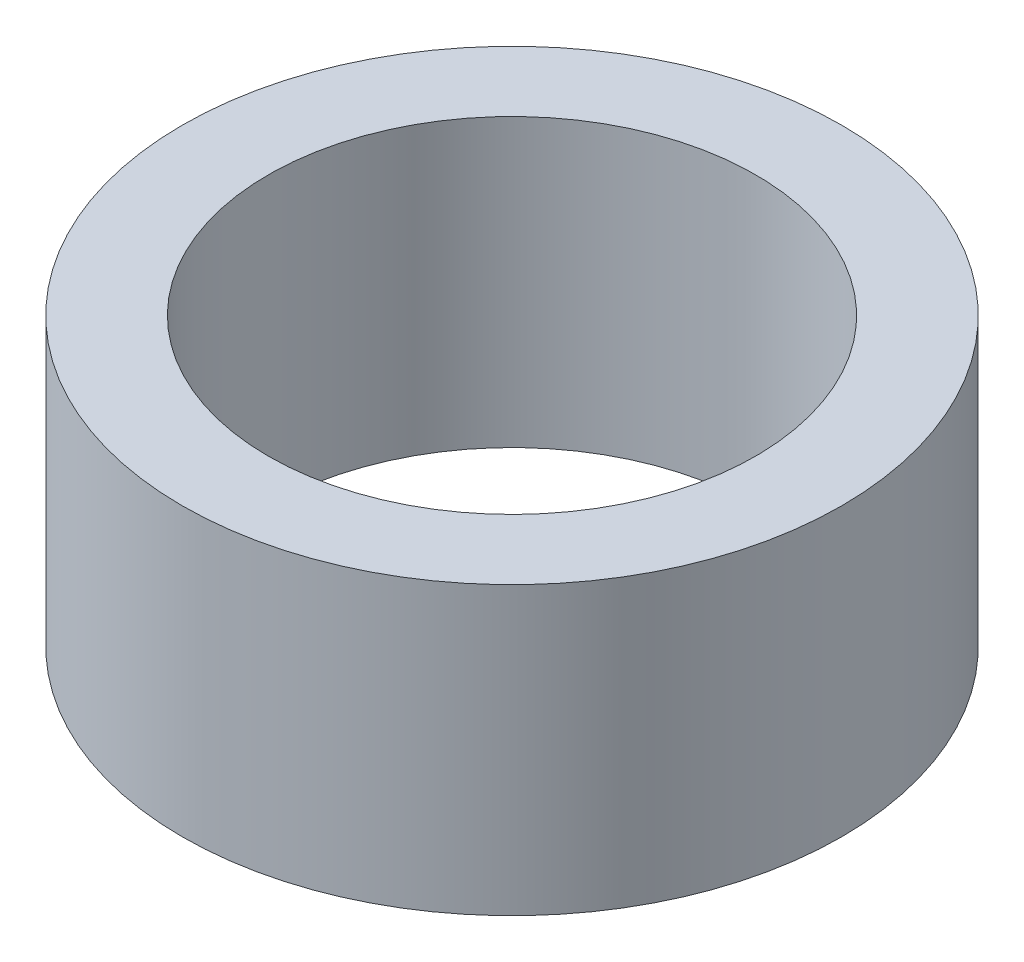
SolidWorks part; units mm, degrees
ref_plane "Alzado" through (0, 0, 0) normal (0, 0, 1) x (1, 0, 0)
ref_plane "Planta" through (0, 0, 0) normal (0, 1, 0) x (1, 0, 0)
ref_plane "Vista lateral" through (0, 0, 0) normal (1, 0, 0) x (0, 0, -1)
sketch "Croquis1" plane through (0, 0, 0) normal (0, 1, 0) x (1, 0, 0)
  circle A0 centre (0, 0) radius 4.25
  circle A1 centre (0, 0) radius 5.75
  dimension "D1" = 8.5
  dimension "D2" = 11.5
extrude "Saliente-Extruir1" add sketch "Croquis1" along normal blind 5
